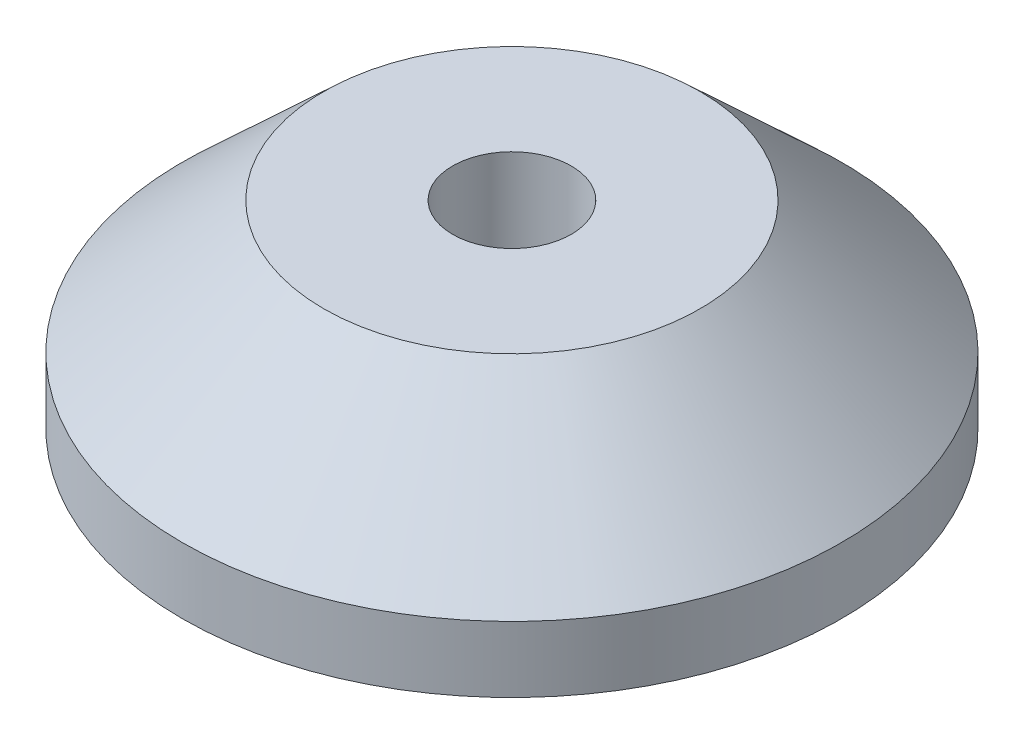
SolidWorks part; units mm, degrees
ref_plane "Front Plane" through (0, 0, 0) normal (0, 0, 1) x (1, 0, 0)
ref_plane "Top Plane" through (0, 0, 0) normal (0, 1, 0) x (1, 0, 0)
ref_plane "Right Plane" through (0, 0, 0) normal (1, 0, 0) x (0, 0, -1)
sketch "Sketch1" plane through (0, 0, 0) normal (0, 1, 0) x (1, 0, 0)
  circle A0 centre (0, 0) radius 50
  dimension "D1" = 100
extrude "Boss-Extrude1" add sketch "Sketch1" along normal blind 10
sketch "Sketch2" plane through (0, 10, 0) normal (0, 1, 0) x (1, 0, 0)
  circle A0 centre (0, 0) radius 50
extrude "Boss-Extrude2" add sketch "Sketch2" along normal blind 21 draft 47
sketch "Sketch3" plane through (0, 31, 0) normal (0, 1, 0) x (1, 0, 0)
  circle A0 centre (0, 0) radius 9
  dimension "D1" = 18
extrude "Cut-Extrude1" cut sketch "Sketch3" against normal blind 20
sketch "Sketch7" plane through (0, 31, 0) normal (0, 1, 0) x (1, 0, 0)
  circle A0 centre (0, 0) radius 37.629
extrude "Cut-Extrude2" cut sketch "Sketch7" against normal blind 1
